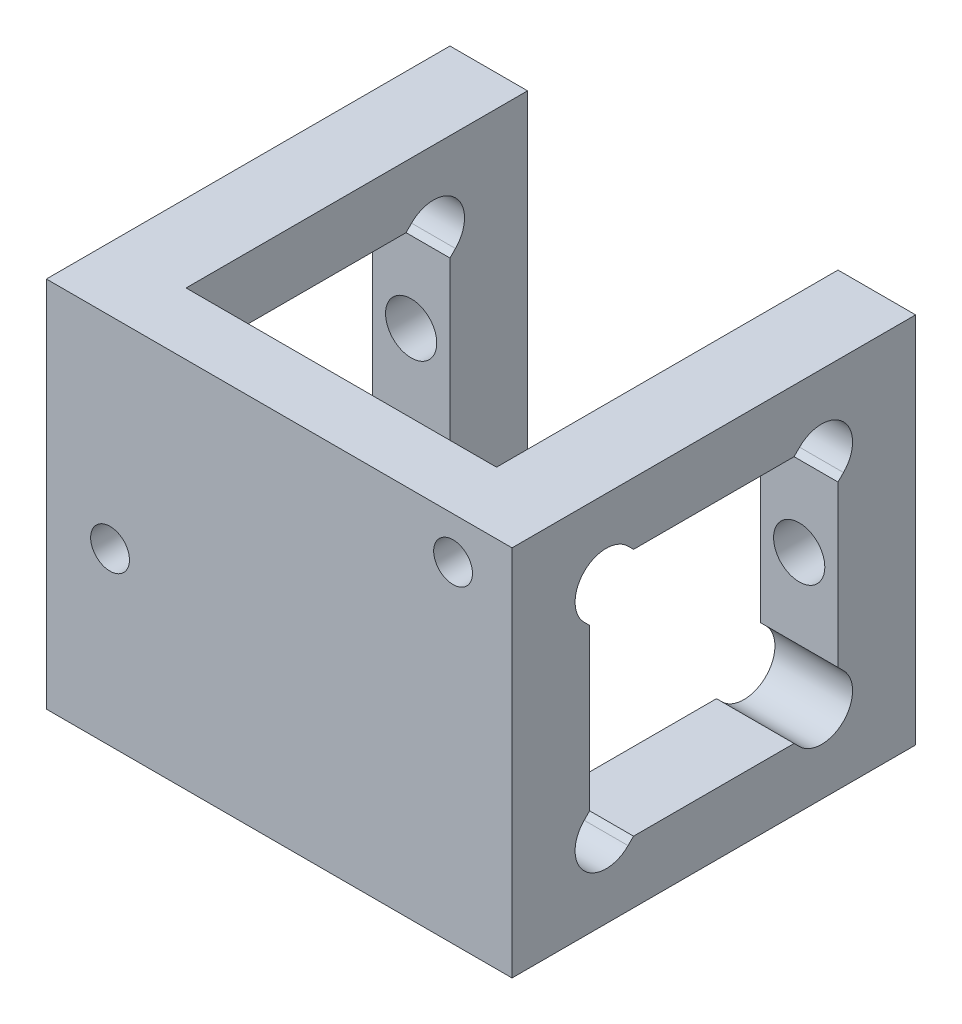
SolidWorks part; units mm, degrees
ref_plane "Plan de face" through (0, 0, 0) normal (0, 0, 1) x (1, 0, 0)
ref_plane "Plan de dessus" through (0, 0, 0) normal (0, 1, 0) x (1, 0, 0)
ref_plane "Plan de droite" through (0, 0, 0) normal (1, 0, 0) x (0, 0, -1)
sketch "Esquisse1" plane through (0, 0, 0) normal (0, 0, 1) x (1, 0, 0)
  line L1 (0, 0) -> (30, 0)
  line L2 (0, 0) -> (0, -24)
  line L3 (0, -24) -> (30, -24)
  line L4 (30, 0) -> (30, -24)
  dimension "D1" = 30
  dimension "D2" = 24
extrude "Boss.-Extru.1" add sketch "Esquisse1" along normal blind 4 from offset 9
sketch "Esquisse4" plane through (0, 0, 0) normal (-1, 0, 0) x (0, 0, 1)
  line L0 (13, 0) -> (9, 0) construction
  line L1 (-8, -4) -> (8, -4) construction
  line L2 (-8, -4) -> (-8, -20) construction
  line L3 (-8, -20) -> (8, -20) construction
  line L4 (8, -4) -> (8, -20) construction
  line L6 (-13, 0) -> (13, 0)
  line L7 (-13, 0) -> (-13, -24)
  line L8 (-13, -24) -> (13, -24)
  line L9 (13, 0) -> (13, -24)
  line L10 (-8, -4) -> (8, -4)
  line L11 (-8, -4) -> (-8, -20)
  line L12 (-8, -20) -> (8, -20)
  line L13 (8, -4) -> (8, -20)
  dimension "D1" = 16
  dimension "D2" = 8
  dimension "D3" = 4
  dimension "D4" = 5
  dimension "D5" = 5
  dimension "D6" = 4
extrude "Boss.-Extru.3" add sketch "Esquisse4" against normal blind 5
sketch "Esquisse10" plane through (0, 0, 0) normal (-1, 0, 0) x (0, 0, 1)
  line L0 (8, -20) -> (-8, -4) construction
  line L1 (-5.5251, -3.6464) -> (-3.4236, -5.748)
  line L2 (-8.3536, -6.4749) -> (-6.5745, -8.2539)
  line L3 (-6.5745, -8.2539) -> (-3.4236, -5.748)
  line L4 (-8, -20) -> (8, -4) construction
  line L5 (8, -20) -> (8, -4) construction
  line L6 (8.3526, -6.4739) -> (6.251, -8.5754)
  line L7 (3.7451, -5.4245) -> (6.251, -8.5754)
  line L8 (5.5241, -3.6454) -> (3.7451, -5.4245)
  line L9 (5.5251, -20.3516) -> (3.4236, -18.25)
  line L10 (6.5745, -15.7441) -> (3.4236, -18.25)
  line L11 (8.3536, -17.5231) -> (6.5745, -15.7441)
  line L12 (-8.3526, -17.5241) -> (-6.251, -15.4226)
  line L13 (-3.7451, -18.5735) -> (-6.251, -15.4226)
  line L14 (-5.5241, -20.3526) -> (-3.7451, -18.5735)
  arc A0 (-5.5251, -3.6464) -> (-8.3536, -6.4749) centre (-6.9393, -5.0607) ccw
  arc A1 (8.3526, -6.4739) -> (5.5241, -3.6454) centre (6.9383, -5.0597) ccw
  arc A2 (5.5251, -20.3516) -> (8.3536, -17.5231) centre (6.9393, -18.9373) ccw
  arc A3 (-8.3526, -17.5241) -> (-5.5241, -20.3526) centre (-6.9383, -18.9383) ccw
  point P14 (0, -12)
  dimension "D1" = 4
  dimension "D2" = 1.5
  dimension "D3" = 4
extrude "Enlèv. mat.-Extru.3" cut sketch "Esquisse10" against normal blind 10
sketch "Esquisse11" plane through (30, 0, 0) normal (1, 0, 0) x (0, 0, -1)
  line L0 (5.5251, -3.6464) -> (3.4236, -5.748) construction
  line L2 (8.3536, -6.4749) -> (6.5745, -8.2539) construction
  line L3 (-5.5251, -20.3516) -> (-3.4236, -18.25) construction
  line L4 (13, 0) -> (-9, 0)
  line L5 (-9, 0) -> (-9, -24)
  line L6 (-9, -24) -> (13, -24)
  line L7 (13, -24) -> (13, 0)
  line L8 (13, 0) -> (-9, 0)
  line L9 (-9, 0) -> (-9, -24)
  line L10 (-9, -24) -> (13, -24)
  line L11 (13, -24) -> (13, 0)
  line L13 (-8.3536, -17.5231) -> (-6.5745, -15.7441) construction
  line L14 (-8.3526, -6.4739) -> (-6.251, -8.5754) construction
  line L16 (-5.5241, -3.6454) -> (-3.7451, -5.4245) construction
  line L18 (8.3526, -17.5241) -> (6.251, -15.4226) construction
  line L19 (5.5241, -20.3526) -> (3.7451, -18.5735) construction
  line L20 (5.5251, -3.6464) -> (5.1716, -4)
  line L22 (8.3536, -6.4749) -> (8, -6.8284)
  line L23 (-5.5251, -20.3516) -> (-5.1736, -20)
  line L25 (-8.3536, -17.5231) -> (-8, -17.1696)
  line L26 (-8.3526, -6.4739) -> (-8, -6.8264)
  line L28 (-5.5241, -3.6454) -> (-5.1696, -4)
  line L30 (8.3526, -17.5241) -> (8, -17.1716)
  line L31 (5.5241, -20.3526) -> (5.1716, -20)
  line L32 (8, -4) -> (8, -20) construction
  line L33 (8, -20) -> (-8, -20) construction
  line L34 (-8, -4) -> (-8, -20) construction
  line L35 (8, -4) -> (-8, -4) construction
  line L36 (8, -6.8284) -> (8, -17.1716)
  line L37 (5.1716, -20) -> (-5.1736, -20)
  line L38 (-8, -6.8264) -> (-8, -17.1696)
  line L39 (5.1716, -4) -> (-5.1696, -4)
  arc A0 (8.3536, -6.4749) -> (5.5251, -3.6464) centre (6.9393, -5.0607) ccw construction
  arc A1 (-8.3536, -17.5231) -> (-5.5251, -20.3516) centre (-6.9393, -18.9373) ccw construction
  arc A2 (-5.5241, -3.6454) -> (-8.3526, -6.4739) centre (-6.9383, -5.0597) ccw construction
  arc A3 (5.5241, -20.3526) -> (8.3526, -17.5241) centre (6.9383, -18.9383) ccw construction
  arc A4 (8.3536, -6.4749) -> (5.5251, -3.6464) centre (6.9393, -5.0607) ccw
  arc A5 (-8.3536, -17.5231) -> (-5.5251, -20.3516) centre (-6.9393, -18.9373) ccw
  arc A6 (-5.5241, -3.6454) -> (-8.3526, -6.4739) centre (-6.9383, -5.0597) ccw
  arc A7 (5.5241, -20.3526) -> (8.3526, -17.5241) centre (6.9383, -18.9383) ccw
  dimension "D1" = 0
extrude "Boss.-Extru.4" add sketch "Esquisse11" against normal blind 5
hole_wizard "Trou taraudé M42" positions "Esquisse15" profile "Esquisse14" tap size "M4" standard "ISO"
sketch "Esquisse15" plane through (0, 0, -13) normal (0, 0, -1) x (-1, 0, 0)
  line L0 (0, 0) -> (0, -24) construction
  line L1 (-30, -24) -> (-30, 0) construction
  line L2 (-5, 0) -> (0, 0) construction
  point P0 (-27.5, -12)
  point P1 (-2.5, -12)
  dimension "D1" = 2.5
  dimension "D2" = 2.5
  dimension "D3" = 12
sketch "Esquisse14" plane through (27.5, -12, -13) normal (1, 0, 0) x (0, 1, 0)
  line L0 (0, 0) -> (0, 12.4914)
  line L1 (0, 12.4914) -> (1.65, 11.5)
  line L2 (1.65, 11.5) -> (1.65, 0)
  line L5 (1.65, 0) -> (0, 0)
  line L10 (0, 12.4914) -> (-1.65, 11.5) construction
  line L11 (0, -6.35) -> (0, 107.95) construction
  dimension "Diamètre du trou pour taraudage" = 3.3
  dimension "Profondeur du trou pour taraudage" = 11.5
  dimension "Angle de pointe" = 118
hole_wizard "Trou taraudé M31" positions "Esquisse17" profile "Esquisse16" tap size "M3" standard "ISO"
sketch "Esquisse17" plane through (0, 0, 13) normal (0, 0, 1) x (1, 0, 0)
  point P1 (26.2, -2.7)
  point P4 (4.1, -13)
sketch "Esquisse16" plane through (26.2, -2.7, 13) normal (1, 0, 0) x (0, -1, 0)
  line L0 (0, 0) -> (0, 9.2511)
  line L1 (0, 9.2511) -> (1.25, 8.5)
  line L2 (1.25, 8.5) -> (1.25, 0)
  line L5 (1.25, 0) -> (0, 0)
  line L10 (0, 9.2511) -> (-1.25, 8.5) construction
  line L11 (0, -6.35) -> (0, 107.95) construction
  dimension "Diamètre du trou pour taraudage" = 2.5
  dimension "Profondeur du trou pour taraudage" = 8.5
  dimension "Angle de pointe" = 118
